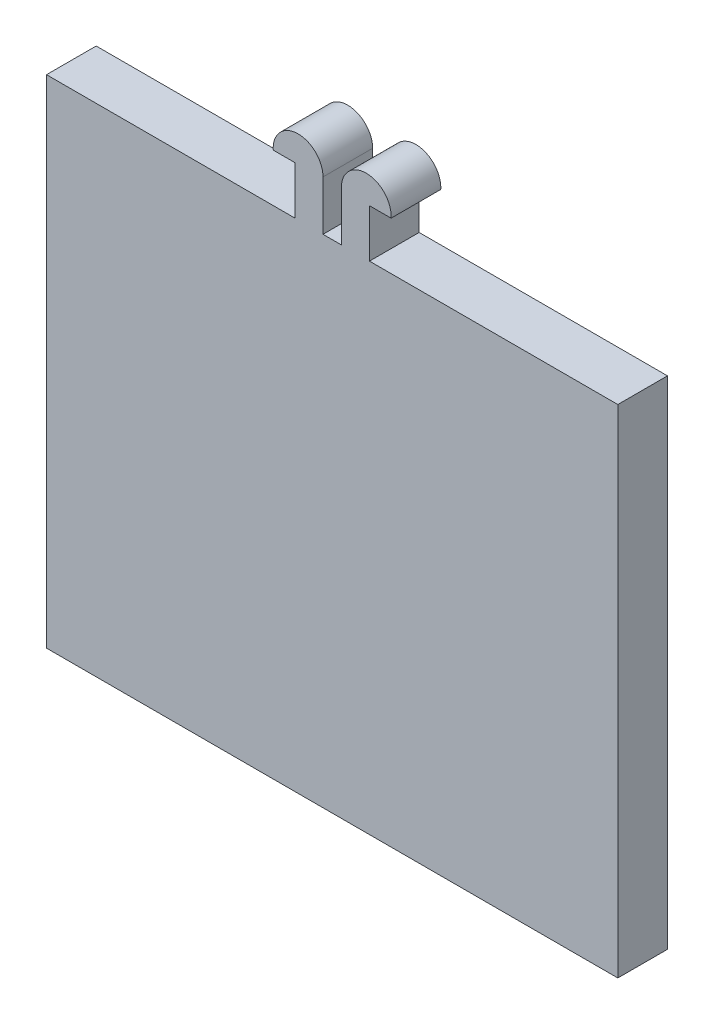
SolidWorks part; units mm, degrees
ref_plane "Front Plane" through (0, 0, 0) normal (0, 0, 1) x (1, 0, 0)
ref_plane "Top Plane" through (0, 0, 0) normal (0, 1, 0) x (1, 0, 0)
ref_plane "Right Plane" through (0, 0, 0) normal (1, 0, 0) x (0, 0, -1)
sketch "Sketch1" plane through (0, 0, 0) normal (0, 0, 1) x (1, 0, 0)
  line L0 (0.654, 15) -> (0.654, 18) construction
  line L1 (17.254, -15) -> (-17.254, -15)
  line L2 (17.254, -15) -> (17.254, 15)
  line L3 (17.254, 15) -> (2.254, 15)
  line L4 (-17.254, -15) -> (-17.254, 15)
  line L5 (17.254, -15) -> (-17.254, 15) construction
  line L6 (17.254, 15) -> (-17.254, -15) construction
  line L7 (2.154, 15) -> (2.154, 18) construction
  line L8 (2.154, 18) -> (3.462, 18) construction
  line L9 (0, 0) -> (0, 30.9137) construction
  line L10 (3.462, 18) -> (3.462, 15) construction
  line L11 (0.554, 15) -> (0.554, 18)
  line L12 (2.254, 17.9) -> (3.5587, 17.9)
  line L13 (2.254, 15) -> (2.254, 17.9)
  line L14 (0.554, 15) -> (0.554, 18) construction
  line L15 (-2.254, 15) -> (-2.254, 17.9)
  line L16 (-2.254, 17.9) -> (-3.5587, 17.9)
  line L17 (-0.554, 15) -> (-0.554, 18)
  line L18 (-0.554, 15) -> (-2.254, 15) construction
  line L19 (-2.254, 15) -> (-17.254, 15)
  line L20 (2.154, 15) -> (0.654, 15) construction
  line L21 (0.554, 15) -> (-0.554, 15)
  line L22 (0.654, 15) -> (0.554, 15) construction
  line L23 (2.254, 15) -> (2.154, 15) construction
  arc A0 (3.462, 18) -> (0.654, 18) centre (2.058, 18) ccw construction
  arc A1 (3.5587, 17.9) -> (0.554, 18) centre (2.058, 18) ccw
  arc A2 (-3.5587, 17.9) -> (-0.554, 18) centre (-2.058, 18) cw
  point P0 (0, 0)
extrude "Boss-Extrude1" add sketch "Sketch1" along normal blind 3
equation "\"Thick\" = 3"
equation "\"h\" = 3"
equation "\"kerf\"= .2"
equation "\"D7@Sketch1\"= 15"
equation "\"Length\"= \"Thick\""
equation "\"D4@Sketch1\" = \"h\" / 2"
equation "\"D5@Sketch1\"= \"h\" / 2"
equation "\"Deflection\"= .4 * \"Thick\""
equation "\"D8@Sketch1\"=\"kerf\"/2"
equation "\"D1@Boss-Extrude1\"=\"Thick\""
equation "\"Strain\"= \"Deflection\" / \"Length\""
equation "\"D3@Sketch1\"=\"Length\""
equation "\"Per_def\"= 1.09 * ( \"Strain\" * \"Length\" * \"Length\" ) / \"h\""
equation "\"D6@Sketch1\" = \"Per_def\" * .5"
equation "\"D2@Sketch1\"= \"Per_def\""
